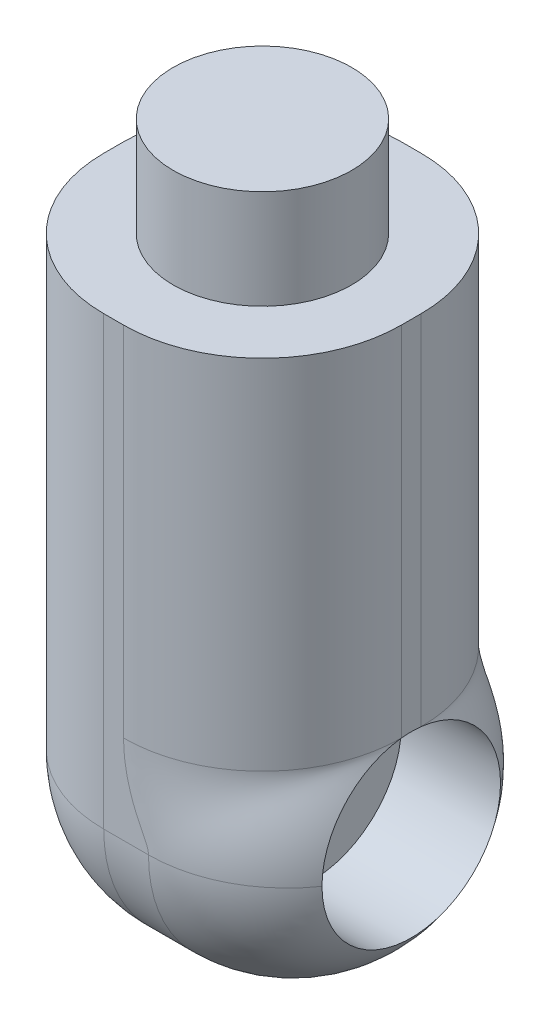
SolidWorks part; units mm, degrees
ref_plane "Plan de face" through (0, 0, 0) normal (0, 0, 1) x (1, 0, 0)
ref_plane "Plan de dessus" through (0, 0, 0) normal (0, 1, 0) x (1, 0, 0)
ref_plane "Plan de droite" through (0, 0, 0) normal (1, 0, 0) x (0, 0, -1)
sketch "Esquisse1" plane through (0, 0, 0) normal (1, 0, 0) x (0, 0, -1)
  line L1 (0, 0) -> (150, 0)
  line L2 (0, 0) -> (0, 300)
  line L3 (0, 300) -> (150, 300)
  line L4 (150, 0) -> (150, 300)
  dimension "D1" = 300
  dimension "D2" = 150
extrude "Boss.-Extru.1" add sketch "Esquisse1" along normal blind 150
sketch "Esquisse2" plane through (0, 300, 0) normal (0, 1, 0) x (1, 0, 0)
  line L0 (75, 150) -> (75, 0) construction
  line L1 (150, 150) -> (0, 150) construction
  line L2 (150, 0) -> (0, 0) construction
  circle A0 centre (75, 75) radius 45
extrude "Boss.-Extru.2" add sketch "Esquisse2" along normal blind 50
sketch "Esquisse3" plane through (150, 0, 0) normal (1, 0, 0) x (0, 0, -1)
  line L0 (0, 0) -> (0, 75) construction
  line L1 (0, 300) -> (0, 0) construction
  line L2 (0, 75) -> (150, 75) construction
  line L3 (150, 0) -> (150, 300) construction
  circle A0 centre (75, 75) radius 45
  dimension "D1" = 75
extrude "Enlèv. mat.-Extru.1" cut sketch "Esquisse3" against normal blind 50
sketch "Esquisse4" plane through (150, 0, 0) normal (1, 0, 0) x (0, 0, -1)
  line L0 (-31.066, 75) -> (0, 75)
  line L1 (181.066, 75) -> (150, 75)
  circle A0 centre (75, 75) radius 75
  arc A1 (0, 0) -> (181.066, 75) centre (75, 75) ccw
  arc A2 (0, 0) -> (-31.066, 75) centre (75, 75) cw
extrude "Enlèv. mat.-Extru.2" cut sketch "Esquisse4" against normal through all contours A2 L0 M3 | A0 M3 M4 | A1 M4 | A0 M4 M5 | A1 L1 M5
fillet "Congé2" radius 70 5 edges at (0, 187.5, -150) (0, 0, -75) (150, 187.5, -150) (0, 187.5, 0) (150, 187.5, 0)
